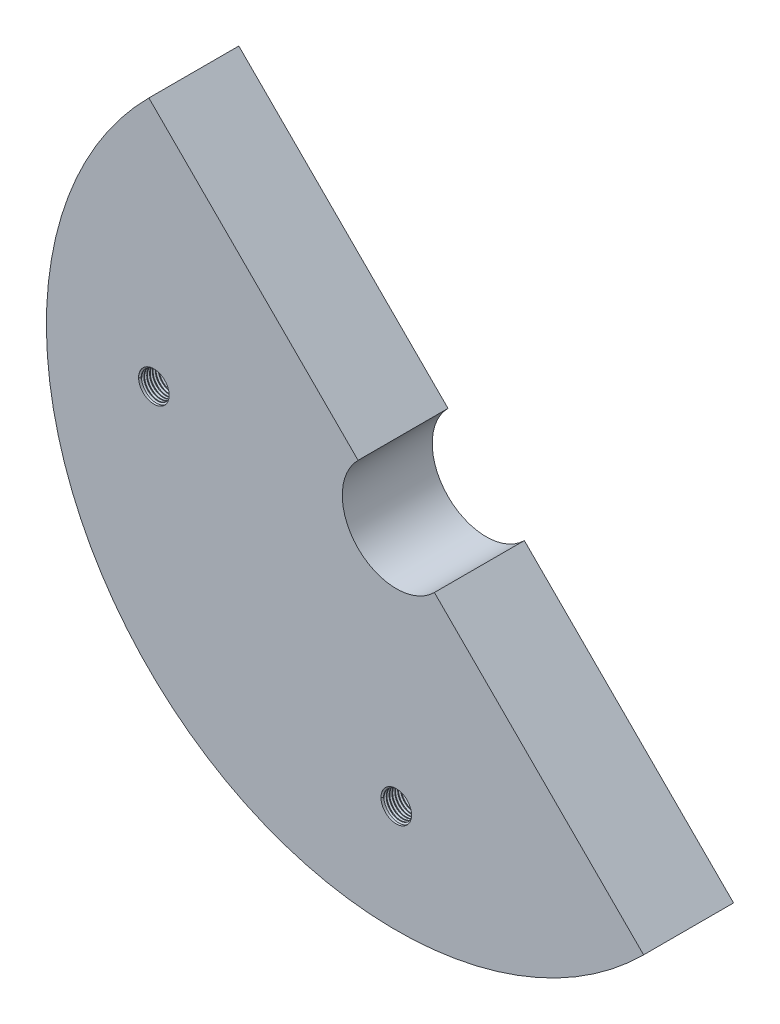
SolidWorks part; units mm, degrees
ref_plane "Plan de face" through (0, 0, 0) normal (0, 0, 1) x (1, 0, 0)
ref_plane "Plan de dessus" through (0, 0, 0) normal (0, 1, 0) x (1, 0, 0)
ref_plane "Plan de droite" through (0, 0, 0) normal (1, 0, 0) x (0, 0, -1)
sketch "Esquisse1" plane through (0, 0, 0) normal (0, 0, 1) x (1, 0, 0)
  line L0 (4.2426, -4.2426) -> (27.5065, -27.5065)
  line L1 (-4.2426, 4.2426) -> (-19.45, 19.45)
  line L2 (-38.9, 0) -> (-15, 0)
  line L3 (-4.2426, 4.2426) -> (-27.5065, 27.5065)
  line L4 (-19.45, 19.45) -> (-27.5065, 27.5065)
  line L6 (0, -38.9) -> (0, -15)
  line L7 (-15, 0) -> (-38.9, 0)
  line L8 (4.2426, -4.2426) -> (27.5065, -27.5065)
  arc A2 (-27.5065, 27.5065) -> (27.5065, -27.5065) centre (0, 0) ccw
  arc A3 (4.2426, -4.2426) -> (-4.2426, 4.2426) centre (0, 0) cw
  arc A4 (4.2426, -4.2426) -> (-4.2426, 4.2426) centre (0, 0) cw
  arc A5 (27.5065, -27.5065) -> (-27.5065, 27.5065) centre (0, 0) cw
  point P11 (0, -26.95)
  point P12 (-26.95, 0)
extrude "Boss.-Extru.3" add sketch "Esquisse1" along normal blind 10
sketch "Esquisse4" plane through (0, 0, 10) normal (0, 0, 1) x (1, 0, 0)
  point P4 (0, 0)
  point P5 (-26.95, 0)
  point P7 (0, -26.95)
  point P16 (-38.9, 0)
hole_wizard "Dégagement M32" positions "Esquisse11" profile "Esquisse12" hole size "M3" standard "AS"
sketch "Esquisse11" plane through (0, 0, 10) normal (0, 0, 1) x (1, 0, 0)
  point P0 (-26.95, 0)
  point P3 (0, -26.95)
sketch "Esquisse12" plane through (-26.95, 0, 10) normal (1, 0, 0) x (0, -1, 0)
  line L0 (0, 0) -> (0, 15)
  line L1 (0, 15) -> (1.7, 15)
  line L2 (1.7, 15) -> (1.7, 0)
  line L5 (1.7, 0) -> (0, 0)
  line L10 (0, 15) -> (-1.7, 15) construction
  line L11 (0, -6.35) -> (0, 107.95) construction
  dimension "Diamètre du perçage" = 3.4
  dimension "Profondeur du perçage" = 15
  dimension "Angle de pointe" = 180
thread "Filetage8" pitch 0.3175 start angle 0, offset 0, length 10, pitch 0.3175, diameter 3.4
ref_plane "Plan8" through (-28.65, 0, 10) normal (0, -1, 0) x (-1, 0, 0)
sketch "Profil de filetage8" plane through (-28.65, 0, 10) normal (0, -1, 0) x (-1, 0, 0)
  line L0 (0, 0) -> (0, 0.3175) construction
  line L11 (0, 0) -> (0, 0.2778)
  line L12 (0, 0.2778) -> (-0.1719, 0.1786)
  line L13 (-0.1719, 0.1786) -> (-0.1719, 0.0992)
  line L15 (-0.1719, 0.0992) -> (0, 0)
  line L17 (-0.1719, 0.1389) -> (0, 0.1389) construction
  point P2 (0, 0)
  dimension "Pitch" = 0.3175
  dimension "Profile_Angle" = 60
  dimension "Profile_Land" = 0.0794
  dimension "Profile_Height" = 0.1719
thread "Filetage9" pitch 0.3175 start angle 0, offset 0, length 10, pitch 0.3175, diameter 3.4
ref_plane "Plan9" through (-1.7, -26.95, 10) normal (0, -1, 0) x (-1, 0, 0)
sketch "Profil de filetage9" plane through (-1.7, -26.95, 10) normal (0, -1, 0) x (-1, 0, 0)
  line L0 (0, 0) -> (0, 0.3175) construction
  line L11 (0, 0) -> (0, 0.2778)
  line L12 (0, 0.2778) -> (-0.1719, 0.1786)
  line L13 (-0.1719, 0.1786) -> (-0.1719, 0.0992)
  line L15 (-0.1719, 0.0992) -> (0, 0)
  line L17 (-0.1719, 0.1389) -> (0, 0.1389) construction
  point P2 (0, 0)
  dimension "Pitch" = 0.3175
  dimension "Profile_Angle" = 60
  dimension "Profile_Land" = 0.0794
  dimension "Profile_Height" = 0.1719
